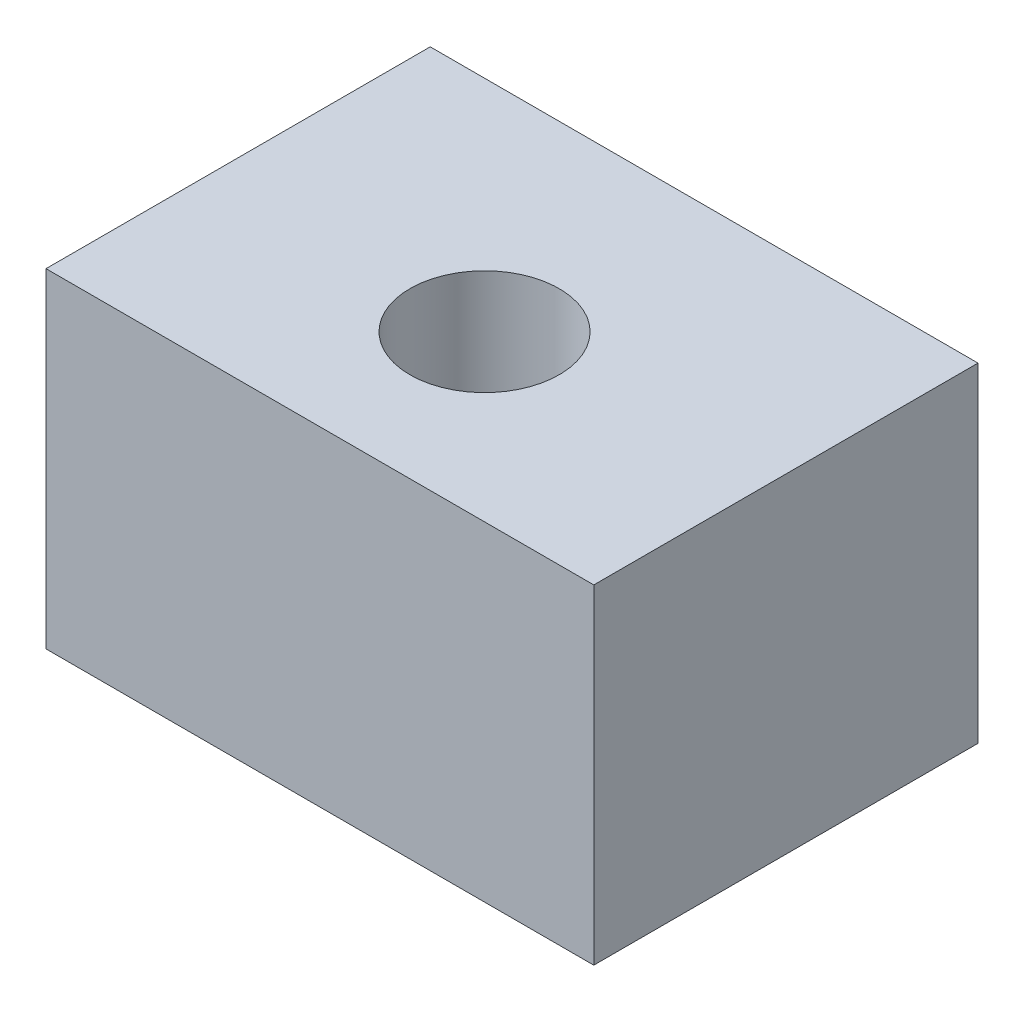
SolidWorks part; units mm, degrees
ref_plane "Front Plane" through (0, 0, 0) normal (0, 0, 1) x (1, 0, 0)
ref_plane "Top Plane" through (0, 0, 0) normal (0, 1, 0) x (1, 0, 0)
ref_plane "Right Plane" through (0, 0, 0) normal (1, 0, 0) x (0, 0, -1)
sketch "Sketch1" plane through (0, 0, 0) normal (0, 0, 1) x (1, 0, 0)
  line L1 (0, 0) -> (12.6746, 0)
  line L2 (0, 0) -> (0, 7.62)
  line L3 (0, 7.62) -> (12.6746, 7.62)
  line L4 (12.6746, 0) -> (12.6746, 7.62)
extrude "Boss-Extrude1" add sketch "Sketch1" along normal blind 8.89
hole_wizard "#4 Clearance Hole1" positions "Sketch2" profile "Sketch3" hole size "#4" standard "ANSI Inch"
sketch "Sketch2" plane through (0, 7.62, 0) normal (0, 1, 0) x (1, 0, 0)
  line L0 (6.3373, -5.08) -> (6.3373, -8.89) construction
  line L1 (12.6746, -8.89) -> (0, -8.89) construction
  point P0 (6.3373, -5.08)
sketch "Sketch3" plane through (6.3373, 7.62, 5.08) normal (1, 0, 0) x (0, 0, 1)
  line L0 (0, 0) -> (0, 7.62)
  line L1 (0, 7.62) -> (1.7272, 7.62)
  line L2 (1.7272, 7.62) -> (1.7272, 0)
  line L5 (1.7272, 0) -> (0, 0)
  line L11 (0, -6.35) -> (0, 107.95) construction
  dimension "Thru Hole Dia." = 3.4544
  dimension "Thru Hole Depth" = 7.62
sketch "Sketch5" plane through (0, 7.62, 0) normal (0, 1, 0) x (1, 0, 0)
  circle A0 centre (6.3373, -5.08) radius 3.9624 construction
